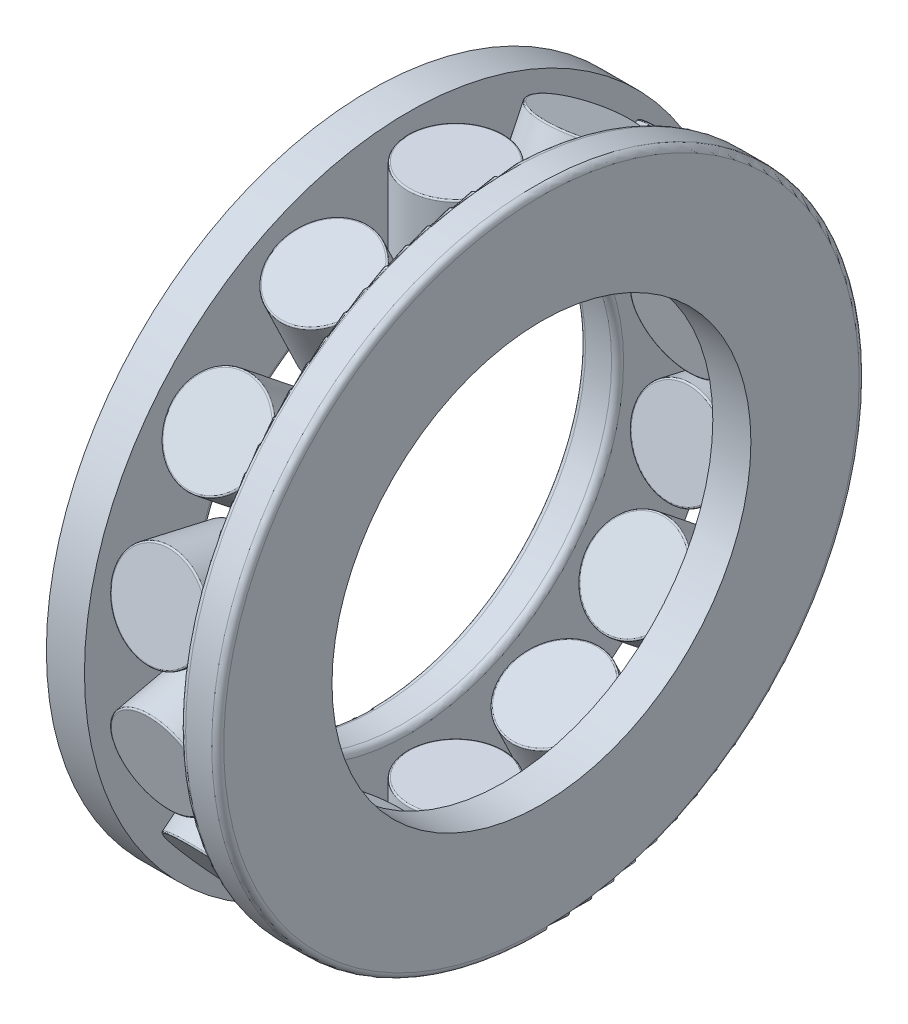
SolidWorks part; units mm, degrees
ref_plane "Plane1" through (0, 0, 0) normal (0, 0, 1) x (1, 0, 0)
ref_plane "Plane2" through (0, 0, 0) normal (0, 1, 0) x (1, 0, 0)
ref_plane "Plane3" through (0, 0, 0) normal (1, 0, 0) x (0, 0, -1)
sketch "Clipboard" plane through (0, 0, 0) normal (0, 0, 1) x (1, 0, 0)
  line L0 (-10, 0) -> (10, 0) construction
  line L1 (0, 0) -> (21.6965, -5.4095)
  line L2 (0, 0) -> (27.3662, 35.0271)
  line L3 (0, 0) -> (13.7666, -17.6205)
  line L4 (0, 0) -> (-22.3471, -0.7804)
  dimension "BallCLRad" = 44.45
  dimension "Count" = 52
  dimension "Show_count" = 52
  dimension "Max_count" = 14
  dimension "Min_count" = 2
sketch "InnRacSke" plane through (0, 0, 0) normal (0, 0, 1) x (1, 0, 0)
  line L1 (-7.9375, 34.925) -> (-14.2875, 34.925)
  line L2 (-14.2875, 34.925) -> (-14.2875, 53.975)
  line L3 (-14.2875, 53.975) -> (-7.9375, 53.975)
  line L4 (-7.9375, 53.975) -> (-7.9375, 34.925)
  line L5 (-34.925, 0) -> (34.925, 0) construction
  line L6 (0, 0) -> (0, 25.4) construction
  dimension "ID" = 69.85
  dimension "OD" = 107.95
  dimension "Width" = 28.575
  dimension "gap" = 15.875
revolve "Race" add sketch "InnRacSke" angle 360 about L5
ref_axis "Axis1" through (-50, 0, 0) along (1, 0, 0)
sketch "RolDetSke" plane through (0, 0, 0) normal (0, 0, 1) x (1, 0, 0)
  line L0 (0, 33.02) -> (0, 55.88) construction
  line L3 (0, 50.8) -> (7.7232, 50.8)
  line L4 (0, 50.8) -> (0, 38.1)
  line L5 (0, 38.1) -> (7.7232, 38.1)
  line L6 (7.9772, 50.546) -> (7.9772, 38.354)
  arc A0 (7.9772, 38.354) -> (7.7232, 38.1) centre (7.7232, 38.354) cw
  arc A1 (7.7232, 50.8) -> (7.9772, 50.546) centre (7.7232, 50.546) cw
  dimension "D1" = 0.254
  dimension "Roller_diameter" = 15.9544
  dimension "Cyl_Len" = 12.7
  dimension "offset" = 38.1
revolve "RollerDetailed" add sketch "RolDetSke" angle 360 about L0
sketch "RolSimSke" plane through (0, 0, 0) normal (0, 0, 1) x (1, 0, 0)
  line L1 (-17.78, 0) -> (12.7, 0) construction
  line L3 (-7.7232, 50.8) -> (7.7232, 50.8)
  line L4 (-7.9772, 50.546) -> (-7.9772, 38.354)
  line L5 (-7.7232, 38.1) -> (7.7232, 38.1)
  line L6 (7.9772, 50.546) -> (7.9772, 38.354)
  arc A0 (-7.9772, 38.354) -> (-7.7232, 38.1) centre (-7.7232, 38.354) ccw
  arc A1 (-7.7232, 50.8) -> (-7.9772, 50.546) centre (-7.7232, 50.546) ccw
  arc A2 (7.9772, 50.546) -> (7.7232, 50.8) centre (7.7232, 50.546) ccw
  arc A3 (7.7232, 38.1) -> (7.9772, 38.354) centre (7.7232, 38.354) ccw
  dimension "Rol_rad" = 0.254
  dimension "Roller_diameter" = 15.9544
  dimension "Cyl_Len" = 12.7
  dimension "offset" = 38.1
  dimension "Halfdia" = 7.9772
revolve "RollersSimplified" [suppressed] add sketch "RolSimSke" angle 360 about L1
mirror "Mirror1" about plane through (0, 0, 0) normal (1, 0, 0) of "Race"
fillet "Fillet" radius 1 4 edges at (7.9375, 0, -53.975) (14.2875, 0, -53.975) (-7.9375, 0, -34.925) (-14.2875, 0, -34.925)
pattern_circular "RollersDetailed" count 14 every 25.714 about axis through (-50, 0, 0) along (1, 0, 0) of "RollerDetailed"
sketch "CagSpiSke" plane through (0, 0, 0) normal (0, 0, 1) x (1, 0, 0)
  line L0 (2.3932, 35.6235) -> (2.3932, 52.8955)
  line L1 (2.3932, 52.8955) -> (-2.3932, 52.8955)
  line L2 (-2.3932, 35.6235) -> (-2.3932, 52.8955)
  line L3 (-2.3932, 35.6235) -> (2.3932, 35.6235)
  line L4 (-34.925, 0) -> (34.925, 0) construction
  line L5 (0, 0) -> (0, 63.1161) construction
  dimension "Thickness" = 4.7863
  dimension "ID" = 71.247
  dimension "OD" = 105.791
revolve "CageSpine" [suppressed] add sketch "CagSpiSke" angle 360 about L4
equation "\"BallCLRad@Clipboard\" =  ( \"OD@InnRacSke\" + \"ID@InnRacSke\" )  / 4"
equation "\"offset@RolDetSke\" = \"BallCLRad@Clipboard\" - \"Cyl_Len@RolDetSke\" / 2"
equation "\"Cyl_Len@RolSimSke\" = \"Cyl_Len@RolDetSke\""
equation "\"offset@RolSimSke\" = \"BallCLRad@Clipboard\" - \"Cyl_Len@RolSimSke\" / 2"
equation "\"Roller_diameter@RolDetSke\" = \"gap@InnRacSke\" * 1.005"
equation "\"Roller_diameter@RolSimSke\" = \"gap@InnRacSke\" * 1.005"
equation "\"Max_count@Clipboard\" = int( 3.14159265 / atn(( \"Roller_diameter@RolDetSke\" / 2) / sqr( \"offset@RolDetSke\"  *  \"offset@RolDetSke\" - ( \"Roller_diameter@RolDetSke\" / 2) *  ( \"Roller_diameter@RolDetSke\" "
equation "\"Max_count@Clipboard\" = ((sgn( \"Max_count@Clipboard\" - \"Count@Clipboard\" )-1)*( \"Max_count@Clipboard\" - \"Count@Clipboard\" ))/-2+ \"Count@Clipboard\""
equation "\"Count@RollersDetailed\" = int( \"Show_count@Clipboard\" ) "
equation "\"Count@RollersDetailed\" = ((sgn( \"Count@RollersDetailed\" - \"Max_count@Clipboard\" )-1)*( \"Count@RollersDetailed\" - \"Max_count@Clipboard\" ))/-2+ \"Max_count@Clipboard\""
equation "\"Count@RollersDetailed\" = ((sgn( \"Count@RollersDetailed\" - \"Min_count@Clipboard\" )+1)*( \"Count@RollersDetailed\" - \"Min_count@Clipboard\"))/2 +\"Min_count@Clipboard\""
equation "\"Angle@RollersDetailed\" = 360.0 / \"Max_count@Clipboard\""
equation "\"Angle@CageSpine\" =  \"Angle@RollersDetailed\" * ( \"Count@RollersDetailed\" -1 + int( \"Count@RollersDetailed\" / \"Max_count@Clipboard\" ) )  + 0.001 -  int( \"Count@RollersDetailed\" / \"Max_count@Clipboard\" "
equation "\"Angle@CageSpine\" =  \"Angle@CageSpine\" * int( \"Min_count@Clipboard\" / 2) + int(1 / \"Min_count@Clipboard\")  * 0.001"
equation "\"Thickness@CagSpiSke\" =  \"Roller_diameter@RolDetSke\" * 0.3"
equation "\"OD@CagSpiSke\" = \"OD@InnRacSke\" * 0.98"
equation "\"ID@CagSpiSke\" =  \"ID@InnRacSke\" * 1.02"
equation "\"Halfdia@RolSimSke\" = \"Roller_diameter@RolSimSke\" / 2"
